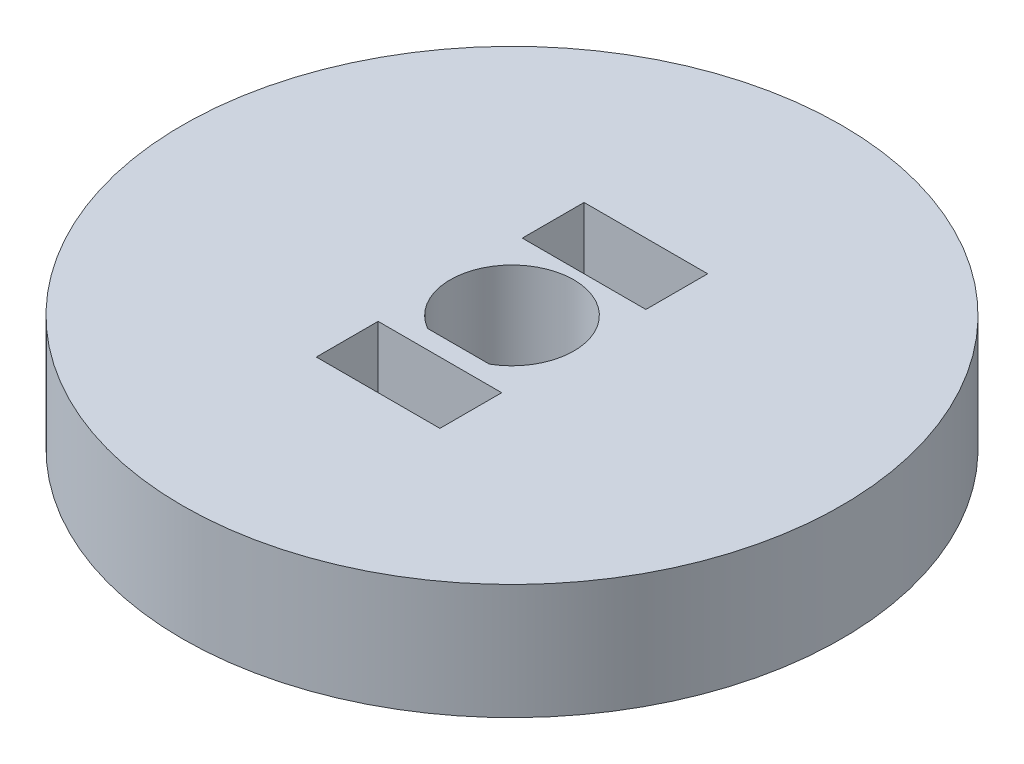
SolidWorks part; units mm, degrees
ref_plane "Front" through (0, 0, 0) normal (0, 0, 1) x (1, 0, 0)
ref_plane "Top" through (0, 0, 0) normal (0, 1, 0) x (1, 0, 0)
ref_plane "Right" through (0, 0, 0) normal (1, 0, 0) x (0, 0, -1)
sketch "草图1" plane through (0, 0, 0) normal (0, 1, 0) x (1, 0, 0)
  line L0 (-1.5, -2.5981) -> (1.5, -2.5981)
  circle A0 centre (0, 0) radius 16
  arc A1 (1.5, -2.5981) -> (-1.5, -2.5981) centre (0, 0) ccw
  point P6 (0, -2.5981)
  dimension "D1" = 32
  dimension "D2" = 6
  dimension "D3" = 3
extrude "凸台-拉伸1" add sketch "草图1" along normal blind 5.6
sketch "草图2" plane through (0, 5.6, 0) normal (0, 1, 0) x (1, 0, 0)
  line L1 (-3, -3.5) -> (3, -3.5)
  line L14 (-3, -3.5) -> (-3, -6.5)
  line L15 (-3, -6.5) -> (3, -6.5)
  line L16 (3, -6.5) -> (3, -3.5)
  line L17 (-3, 3.5) -> (3, 3.5)
  line L18 (3, 3.5) -> (3, 6.5)
  line L19 (3, 6.5) -> (-3, 6.5)
  line L20 (-3, 6.5) -> (-3, 3.5)
  circle A0 centre (0, 0) radius 3 construction
  point P6 (0, -3.5)
  point P13 (0, 3.5)
  dimension "D1" = 3.5
  dimension "D2" = 6
  dimension "D4" = 6
  dimension "D5" = 3
  dimension "D6" = 3
  dimension "D7" = 3.5
extrude "切除-拉伸1" cut sketch "草图2" against normal blind 6
